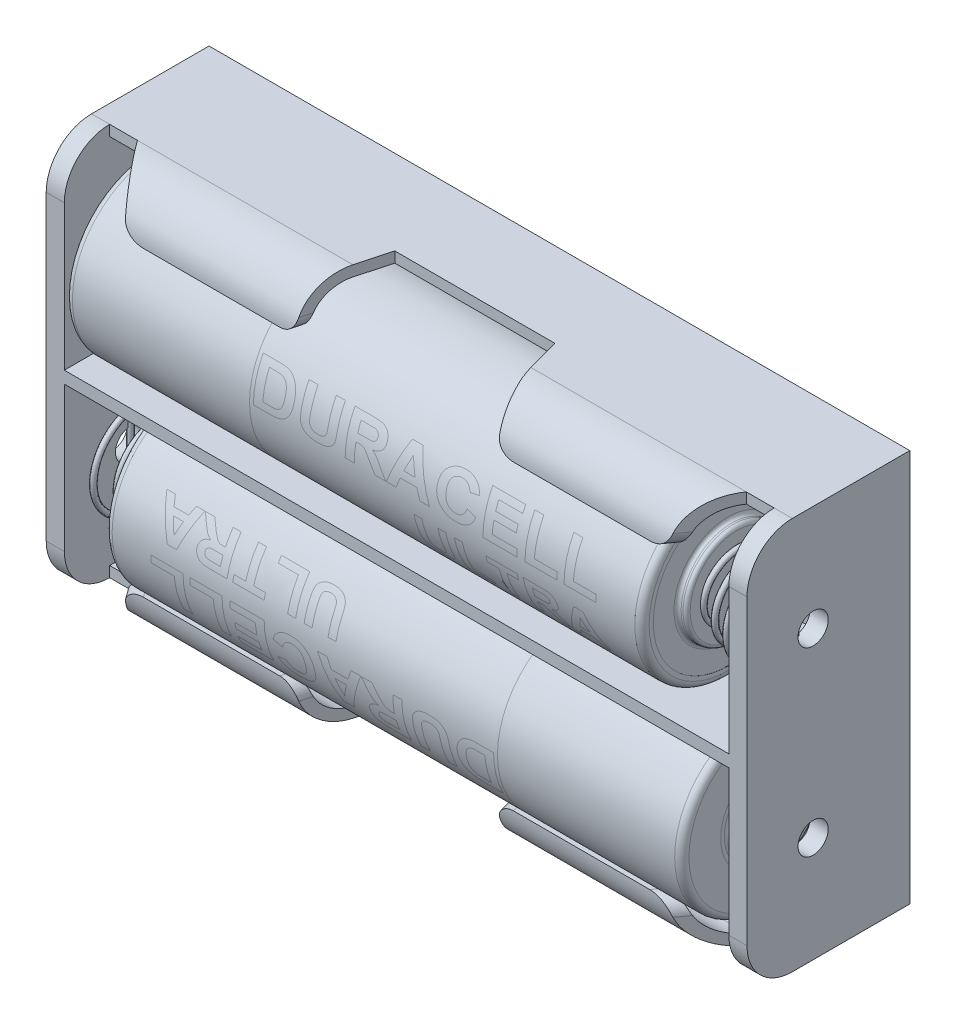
SolidWorks part; units mm, degrees
ref_plane "Front Plane" through (0, 0, 0) normal (0, 0, 1) x (1, 0, 0)
ref_plane "Top Plane" through (0, 0, 0) normal (0, 1, 0) x (1, 0, 0)
ref_plane "Right Plane" through (0, 0, 0) normal (1, 0, 0) x (0, 0, -1)
imported_body "Imported30"
imported_body "Imported31"
imported_body "Imported32"
imported_body "Imported33"
imported_body "Imported34"
imported_body "Imported35"
imported_body "Imported36"
imported_body "Surface-Imported60"
sketch "Sketch1" plane through (-29.464, 0, 0) normal (-1, 0, 0) x (0, 0, 1)
  line L0 (0, 16.51) -> (-7.5766, 16.51)
  line L1 (0, 16.51) -> (9.8806, 16.51)
  line L3 (0, -16.51) -> (9.8806, -16.51)
  line L5 (-7.5766, 16.51) -> (-7.5766, -16.51)
  line L6 (-7.5766, -16.51) -> (0, -16.51)
  line L7 (9.8806, 16.51) -> (17.0116, 16.51)
  line L8 (17.0116, 16.51) -> (17.0116, -16.51)
  line L9 (17.0116, -16.51) -> (9.8806, -16.51)
extrude "Extrude2" cut sketch "Sketch1" along normal blind 70
